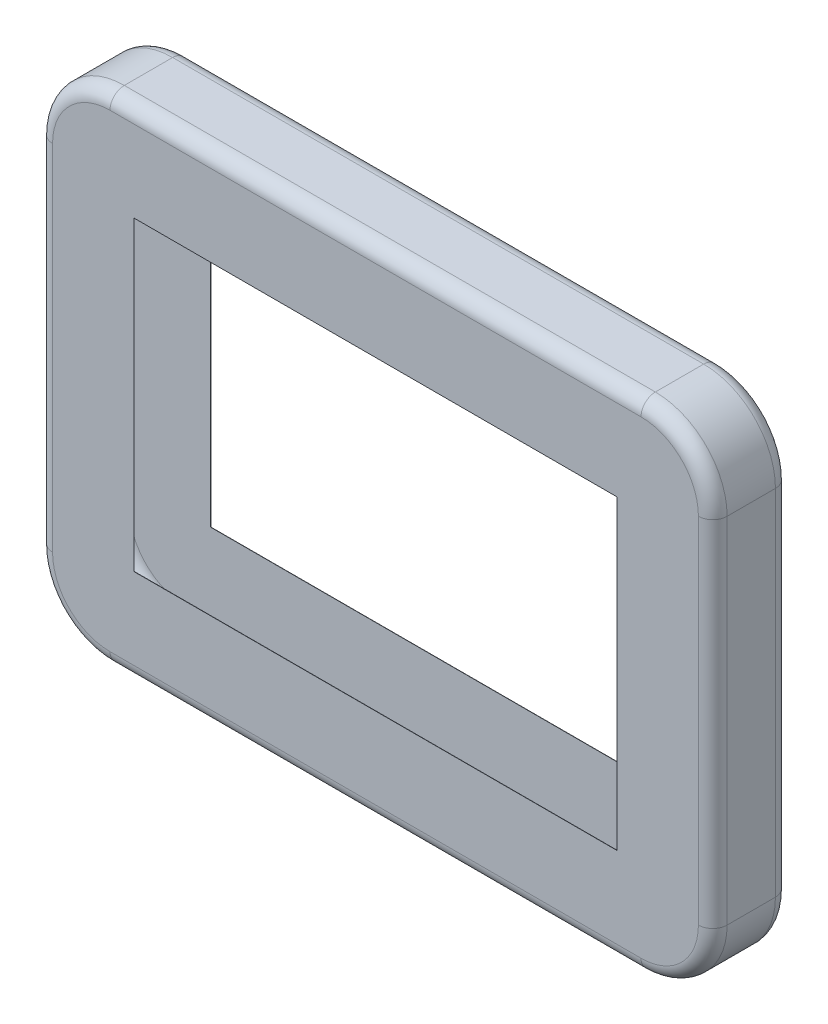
SolidWorks part; units mm, degrees
ref_plane "Plan de face" through (0, 0, 0) normal (0, 0, 1) x (1, 0, 0)
ref_plane "Plan de dessus" through (0, 0, 0) normal (0, 1, 0) x (1, 0, 0)
ref_plane "Plan de droite" through (0, 0, 0) normal (1, 0, 0) x (0, 0, -1)
sketch "Esquisse1" plane through (0, 0, 0) normal (0, 0, 1) x (1, 0, 0)
  line L1 (-111, 94) -> (111, 94)
  line L2 (-131, 74) -> (-131, -74)
  line L3 (-111, -94) -> (111, -94)
  line L4 (131, 74) -> (131, -74)
  arc A0 (-111, 94) -> (-131, 74) centre (-111, 74) ccw
  arc A1 (111, 94) -> (131, 74) centre (111, 74) cw
  arc A2 (111, -94) -> (131, -74) centre (111, -74) ccw
  arc A3 (-131, -74) -> (-111, -94) centre (-111, -74) ccw
  point P6 (-131, 94)
  point P9 (131, 94)
  point P14 (-131, -94)
  dimension "D5" = 20
  dimension "D1" = 262
  dimension "D2" = 188
  dimension "D3" = 131
  dimension "D4" = 94
extrude "Extru.-Mince1" add sketch "Esquisse1" along normal blind 32.2 thin
fillet "Congé1" radius 6 16 edges at (-141, 0, 32.2) (-132.2132, -95.2132, 32.2) (0, -104, 32.2) (132.2132, -95.2132, 32.2) (141, 0, 32.2) (132.2132, 95.2132, 32.2) (0, 104, 32.2) (-132.2132, 95.2132, 32.2) (-141, 0, 0) (-132.2132, -95.2132, 0) (0, -104, 0) (132.2132, -95.2132, 0) (141, 0, 0) (132.2132, 95.2132, 0) (0, 104, 0) (-132.2132, 95.2132, 0)
shell "Coque1" thickness 0.1
